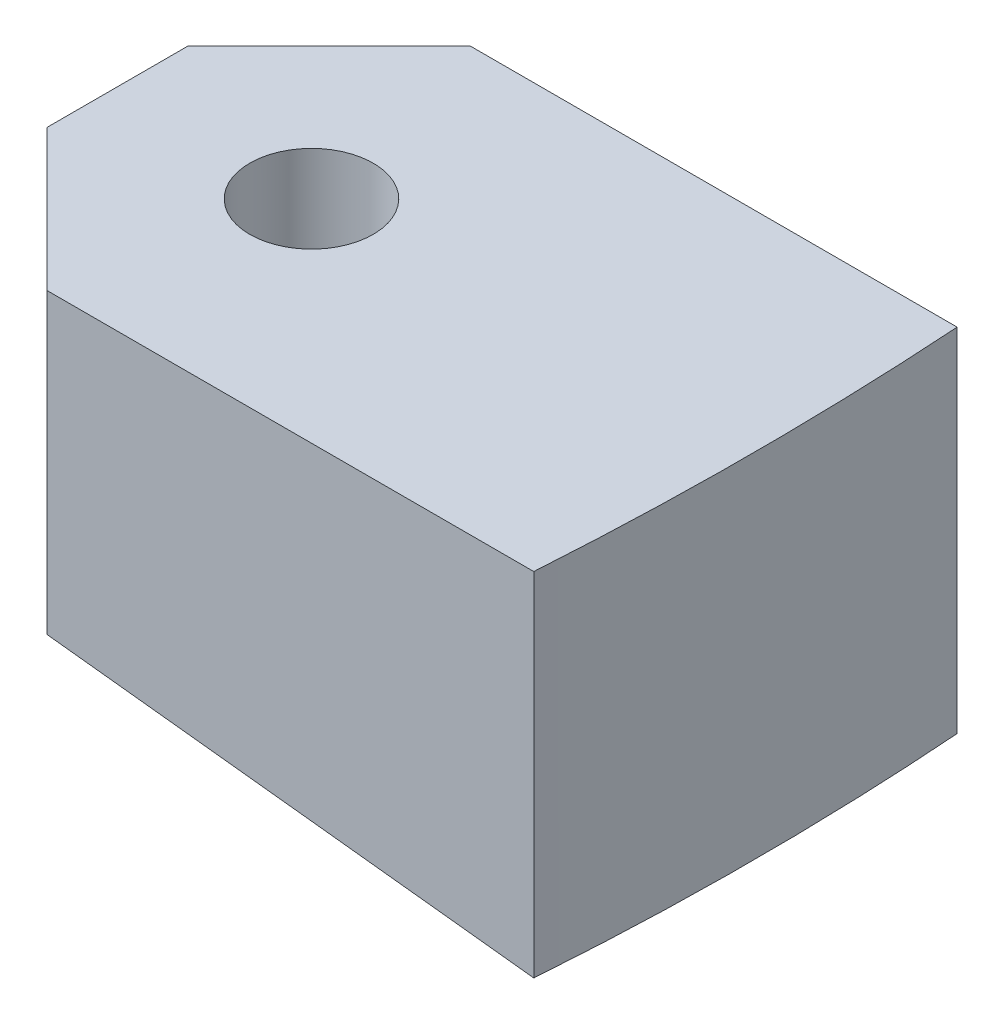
SolidWorks part; units mm, degrees
ref_plane "Plan de face" through (0, 0, 0) normal (0, 0, 1) x (1, 0, 0)
ref_plane "Plan de dessus" through (0, 0, 0) normal (0, 1, 0) x (1, 0, 0)
ref_plane "Plan de droite" through (0, 0, 0) normal (1, 0, 0) x (0, 0, -1)
sketch "Esquisse1" plane through (0, 0, 0) normal (0, 0, 1) x (1, 0, 0)
  line L0 (0, 0) -> (90, 0)
  line L1 (90, 0) -> (90, -50)
  line L2 (90, -50) -> (0, -40)
  line L3 (0, -40) -> (0, 0)
  dimension "D1" = 50
  dimension "D2" = 90
  dimension "D3" = 40
extrude "Boss.-Extru.1" add sketch "Esquisse1" along normal mid plane 60
sketch "Esquisse2" plane through (0, 0, 0) normal (0, 1, 0) x (1, 0, 0)
  line L0 (0, 0) -> (90, 0) construction
  line L1 (90, -30) -> (90, 30) construction
  circle A0 centre (-362.5, 0) radius 452.5
  circle A1 centre (-362.5, 0) radius 500
  dimension "D1" = 905
  dimension "D2" = 1000
extrude "Enlèv. mat.-Extru.1" cut sketch "Esquisse2" against normal through all
hole_wizard "Trou taraudé M201" positions "Esquisse4" profile "Esquisse3" tap size "M20" standard "ISO"
sketch "Esquisse4" plane through (0, 0, 0) normal (0, 1, 0) x (1, 0, 0)
  line L0 (89.0044, 30) -> (0, 30) construction
  line L1 (0, -30) -> (0, 30) construction
  point P0 (27.5, 0)
  dimension "D1" = 30
  dimension "D2" = 27.5
sketch "Esquisse3" plane through (27.5, 0, 0) normal (1, 0, 0) x (0, 0, 1)
  line L0 (0, 0) -> (0, 50)
  line L1 (0, 50) -> (8.75, 50)
  line L2 (8.75, 50) -> (8.75, 0)
  line L5 (8.75, 0) -> (0, 0)
  line L11 (0, -6.35) -> (0, 107.95) construction
  dimension "Diamètre du trou pour taraudage jusqu'au prochain" = 17.5
  dimension "Profondeur du trou pour taraudage jusqu'au prochain" = 50
chamfer "Chanfrein1" distance 20 angle 45 2 edges at (0, -20, -30) (0, -20, 30)
